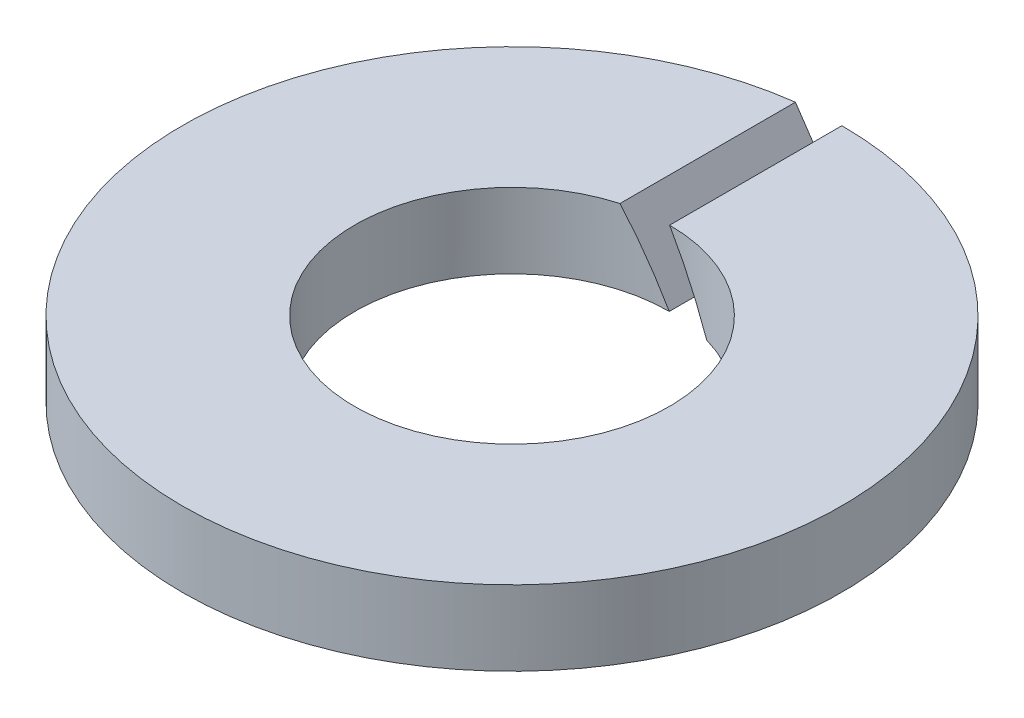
SolidWorks part; units mm, degrees
ref_plane "Front Plane" through (0, 0, 0) normal (0, 0, 1) x (1, 0, 0)
ref_plane "Top Plane" through (0, 0, 0) normal (0, 1, 0) x (1, 0, 0)
ref_plane "Right Plane" through (0, 0, 0) normal (1, 0, 0) x (0, 0, -1)
sketch "BoseSke" plane through (0, 0, 0) normal (0, 1, 0) x (1, 0, 0)
  circle A0 centre (0, 0) radius 1.05
  circle A1 centre (0, 0) radius 2.2
  dimension "Inner_dia" = 2.1
  dimension "Outer_dia" = 4.4
extrude "BaseBody" add sketch "BoseSke" along normal blind 0.5
sketch "SlitSke" plane through (0, 0, 0) normal (0, 0, 1) x (1, 0, 0)
  line L0 (0, 0) -> (-0.2887, 0.5)
  line L1 (1.05, 0.5) -> (-1.05, 0.5) construction
  line L2 (-0.2887, 0.5) -> (0.0023, 0.5)
  line L3 (2.2, 0.5) -> (-2.2, 0.5) construction
  line L4 (0.0023, 0.5) -> (0.291, 0)
  line L5 (-2.2, 0) -> (2.2, 0) construction
  line L6 (0.291, 0) -> (0, 0)
  dimension "D1" = 0.252
  dimension "Angle" = 120
extrude "Slit" cut sketch "SlitSke" against normal through all
equation "\"D1@SlitSke\" = \"Inner_dia@BoseSke\" * 0.12"
